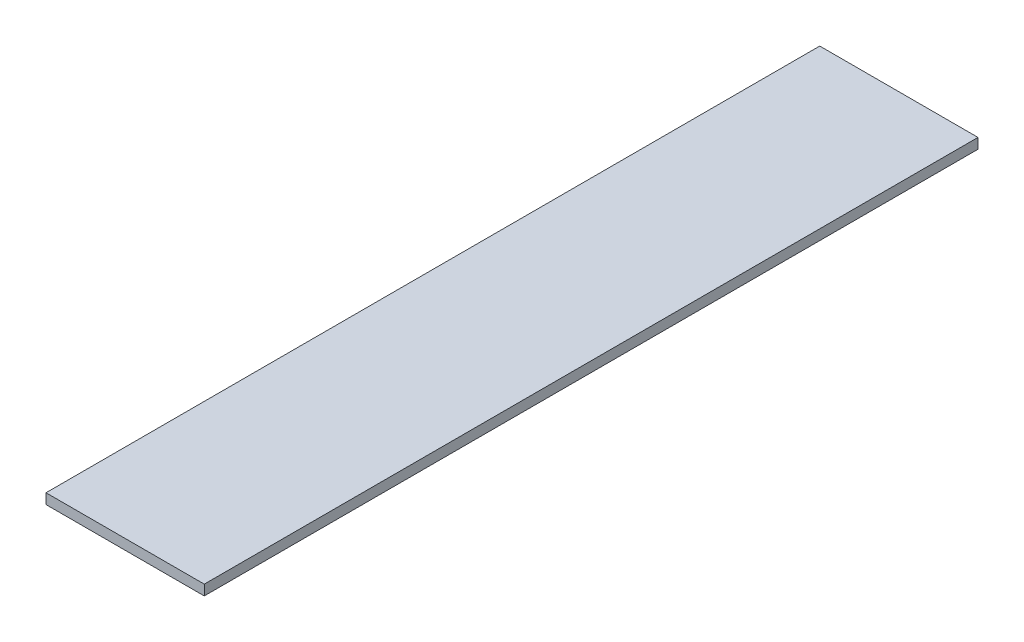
SolidWorks part; units mm, degrees
ref_plane "Front Plane" through (0, 0, 0) normal (0, 0, 1) x (1, 0, 0)
ref_plane "Top Plane" through (0, 0, 0) normal (0, 1, 0) x (1, 0, 0)
ref_plane "Right Plane" through (0, 0, 0) normal (1, 0, 0) x (0, 0, -1)
sketch "Sketch1" plane through (0, 0, 0) normal (0, 1, 0) x (1, 0, 0)
  line L1 (-42.8625, 209.55) -> (42.8625, 209.55)
  line L2 (-42.8625, 209.55) -> (-42.8625, -209.55)
  line L3 (-42.8625, -209.55) -> (42.8625, -209.55)
  line L4 (42.8625, 209.55) -> (42.8625, -209.55)
  line L5 (-42.8625, 209.55) -> (42.8625, -209.55) construction
  line L6 (-42.8625, -209.55) -> (42.8625, 209.55) construction
  point P0 (0, 0)
  dimension "D1" = 85.725
  dimension "D2" = 419.1
extrude "Boss-Extrude1" add sketch "Sketch1" along normal blind 5.5562
